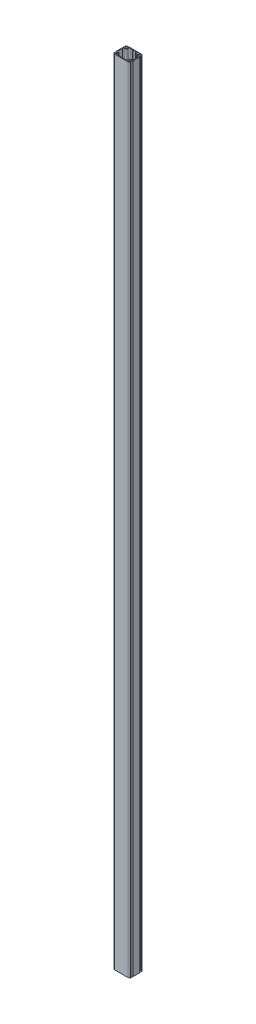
SolidWorks part; units mm, degrees
ref_plane "Alzado" through (0, 0, 0) normal (0, 0, 1) x (1, 0, 0)
ref_plane "Planta" through (0, 0, 0) normal (0, 1, 0) x (1, 0, 0)
ref_plane "Vista lateral" through (0, 0, 0) normal (1, 0, 0) x (0, 0, -1)
sketch "Croquis1" plane through (0, 0, 0) normal (0, 1, 0) x (1, 0, 0)
  line L0 (0, -75.4262) -> (0, 70.5479) construction
  line L1 (-123.9156, -11.6543) -> (129.4204, -11.6543) construction
  line L6 (39.5, 1.486) -> (39.5, 34.9397) construction
  line L7 (19.5039, 17.8457) -> (63.5704, 17.8457) construction
  line L9 (46, -42.8837) -> (46, -42.6992)
  line L10 (22.5, 24.3457) -> (12.5, 24.3457)
  line L12 (39.5, 17.8457) -> (50.0765, 20.3595) construction
  line L13 (47.3463, 21.5924) -> (48.0388, 18.6787) construction
  line L14 (47.3463, -44.9011) -> (48.0388, -41.9874) construction
  line L15 (39.5, -41.1543) -> (50.0765, -43.6682) construction
  line L16 (19.5039, -41.1543) -> (63.5704, -41.1543) construction
  line L17 (39.5, -24.7947) -> (39.5, -58.2483) construction
  line L19 (46, 19.5751) -> (46, 19.3906)
  line L20 (39.5, -51.6543) -> (-39.5, -51.6543)
  line L21 (11, 22.8457) -> (12.5, 24.3457)
  line L22 (46, -24.1543) -> (46, 0.8457)
  line L23 (50, -31.9348) -> (50, 8.6261)
  line L24 (-39.5, -24.7947) -> (-39.5, -58.2483) construction
  line L25 (-19.5039, -41.1543) -> (-63.5704, -41.1543) construction
  line L26 (-39.5, -41.1543) -> (-50.0765, -43.6682) construction
  line L27 (-47.3463, -44.9011) -> (-48.0388, -41.9874) construction
  line L28 (-47.3463, 21.5924) -> (-48.0388, 18.6787) construction
  line L29 (-39.5, 17.8457) -> (-50.0765, 20.3595) construction
  line L30 (-19.5039, 17.8457) -> (-63.5704, 17.8457) construction
  line L31 (-39.5, 1.486) -> (-39.5, 34.9397) construction
  line L32 (123.9156, -11.6543) -> (-129.4204, -11.6543) construction
  line L33 (-50, -31.9348) -> (-50, 8.6261)
  line L34 (-46, -24.1543) -> (-46, 0.8457)
  line L35 (-50, 28.3457) -> (-50, -31.9348)
  line L36 (-39.5, -51.6543) -> (39.5, -51.6543)
  line L38 (-22.5, -47.6543) -> (-12.5, -47.6543)
  line L39 (-22.5, 24.3457) -> (-12.5, 24.3457)
  line L40 (-46, -42.8837) -> (-46, -42.6992)
  line L41 (-39.5, 28.3457) -> (39.5, 28.3457)
  line L42 (46, 0.8457) -> (46, -24.1543)
  line L43 (50, 8.6261) -> (50, -31.9348)
  line L44 (8, 22.8457) -> (6.5, 24.3457)
  line L45 (11, 22.8457) -> (8, 22.8457)
  line L46 (-11, 22.8457) -> (-8, 22.8457)
  line L47 (-8, 22.8457) -> (-6.5, 24.3457)
  line L48 (-11, 22.8457) -> (-12.5, 24.3457)
  line L49 (11, -46.1543) -> (8, -46.1543)
  line L50 (8, -46.1543) -> (6.5, -47.6543)
  line L51 (11, -46.1543) -> (12.5, -47.6543)
  line L52 (-11, -46.1543) -> (-12.5, -47.6543)
  line L53 (-8, -46.1543) -> (-6.5, -47.6543)
  line L54 (-11, -46.1543) -> (-8, -46.1543)
  line L55 (-6.5, -47.6543) -> (6.5, -47.6543)
  line L56 (12.5, -47.6543) -> (22.5, -47.6543)
  line L57 (-12.5, 24.3457) -> (-22.5, 24.3457)
  line L58 (6.5, 24.3457) -> (-6.5, 24.3457)
  line L59 (-6.5, 24.3457) -> (6.5, 24.3457)
  line L60 (12.5, 24.3457) -> (22.5, 24.3457)
  line L61 (-46, 0.8457) -> (-46, -24.1543)
  arc A0 (49.242, 21.7627) -> (39.5, 28.3457) centre (39.5, 17.8457) ccw
  arc A1 (45.5308, 20.2705) -> (43.0455, 12.3978) centre (39.5, 17.8457) ccw
  arc A5 (45.5308, 20.2705) -> (49.242, 21.7627) centre (47.3864, 21.0166) ccw
  arc A6 (29, 17.8457) -> (22.5, 24.3457) centre (22.5, 17.8457) ccw
  arc A7 (46, 0.8457) -> (39.5, 7.3457) centre (39.5, 0.8457) ccw
  arc A9 (50, 8.6261) -> (43.0455, 12.3978) centre (45.5, 8.6261) ccw
  arc A10 (50, -31.9348) -> (43.0455, -35.7064) centre (45.5, -31.9348) cw
  arc A11 (46, -24.1543) -> (39.5, -30.6543) centre (39.5, -24.1543) cw
  arc A12 (29, -41.1543) -> (22.5, -47.6543) centre (22.5, -41.1543) cw
  arc A13 (45.5308, -43.5791) -> (49.242, -45.0713) centre (47.3864, -44.3252) cw
  arc A14 (45.5308, -43.5791) -> (43.0455, -35.7064) centre (39.5, -41.1543) cw
  arc A15 (49.242, -45.0713) -> (39.5, -51.6543) centre (39.5, -41.1543) cw
  arc A16 (29, -41.1543) -> (39.5, -30.6543) centre (39.5, -41.1543) cw
  arc A17 (29, 17.8457) -> (39.5, 7.3457) centre (39.5, 17.8457) ccw
  arc A18 (-29, 17.8457) -> (-39.5, 7.3457) centre (-39.5, 17.8457) cw
  arc A19 (-29, -41.1543) -> (-39.5, -30.6543) centre (-39.5, -41.1543) ccw
  arc A20 (-49.242, -45.0713) -> (-39.5, -51.6543) centre (-39.5, -41.1543) ccw
  arc A21 (-45.5308, -43.5791) -> (-43.0455, -35.7064) centre (-39.5, -41.1543) ccw
  arc A22 (-45.5308, -43.5791) -> (-49.242, -45.0713) centre (-47.3864, -44.3252) ccw
  arc A23 (-29, -41.1543) -> (-22.5, -47.6543) centre (-22.5, -41.1543) ccw
  arc A24 (-46, -24.1543) -> (-39.5, -30.6543) centre (-39.5, -24.1543) ccw
  arc A25 (-50, -31.9348) -> (-43.0455, -35.7064) centre (-45.5, -31.9348) ccw
  arc A26 (-50, 8.6261) -> (-43.0455, 12.3978) centre (-45.5, 8.6261) cw
  arc A27 (-46, 0.8457) -> (-39.5, 7.3457) centre (-39.5, 0.8457) cw
  arc A28 (-29, 17.8457) -> (-22.5, 24.3457) centre (-22.5, 17.8457) cw
  arc A29 (-45.5308, 20.2705) -> (-49.242, 21.7627) centre (-47.3864, 21.0166) cw
  arc A30 (-45.5308, 20.2705) -> (-43.0455, 12.3978) centre (-39.5, 17.8457) cw
  arc A31 (-49.242, 21.7627) -> (-39.5, 28.3457) centre (-39.5, 17.8457) cw
  dimension "D8" = 2
  dimension "D9" = 13
  dimension "D12" = 4.5
  dimension "D2" = 8
  dimension "D3" = 11.6543
  dimension "D4" = 3
  dimension "D5" = 45
  dimension "D6" = 45
  dimension "D10" = 13.37
  dimension "D11" = 8.5
  dimension "D13" = 3.1709
  dimension "D14" = 9.2195
extrude "Saliente-Extruir1" add sketch "Croquis1" along normal blind 4753 contours A31 A29 A30 A26 L33 A25 A21 A22 A20 L20 A15 A13 A14 A10 L23 A9 A1 A5 A0 L41 A18 A28 L39 L48 L46 L47 L58 L44 L45 L21 L10 A6 A17 A7 L22 A11 A16 A12 L56 L51 L49 L50 L55 L53 L54 L52 L38
